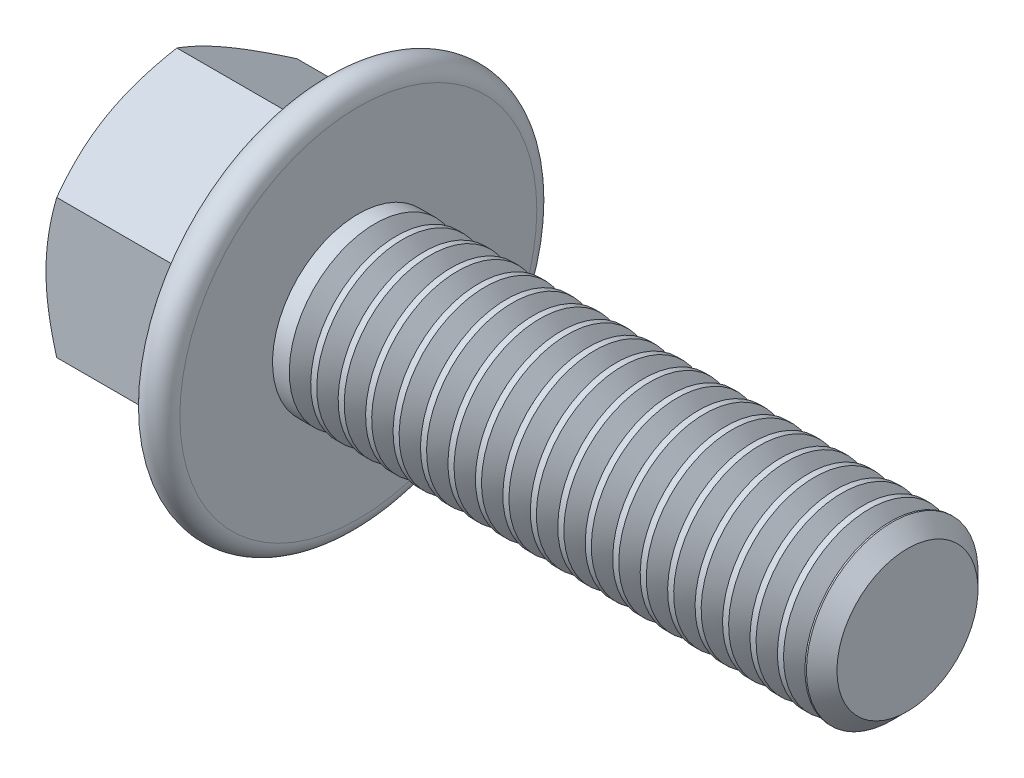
SolidWorks part; units mm, degrees
ref_plane "Plane1" through (0, 0, 0) normal (0, 0, 1) x (1, 0, 0)
ref_plane "Plane2" through (0, 0, 0) normal (0, 1, 0) x (1, 0, 0)
ref_plane "Plane3" through (0, 0, 0) normal (1, 0, 0) x (0, 0, -1)
sketch "Sketch1" plane through (0, 0, 0) normal (1, 0, 0) x (0, 0, -1)
  line L0 (3.5, 2.0207) -> (3.5, -2.0207)
  line L1 (-3.5, 2.0207) -> (-3.5, -2.0207)
  line L2 (3.5, -2.0207) -> (0, -4.0415)
  line L3 (0, -4.0415) -> (-3.5, -2.0207)
  line L4 (3.5, 2.0207) -> (0, 4.0415)
  line L5 (0, 4.0415) -> (-3.5, 2.0207)
  dimension "Width_flats" = 7
  dimension "D2" = 120
  dimension "D3" = 3.5
  dimension "D4" = 3.5
  dimension "D5" = 3.5
extrude "BaseHead" add sketch "Sketch1" along normal blind 5.6
sketch "BodySke" plane through (0, 0, 0) normal (0, 0, 1) x (1, 0, 0)
  line L0 (0, 2.0207) -> (0, -2.0207) construction
  line L1 (0, 0) -> (21.6, 0)
  line L2 (0, 0) -> (0, 2.5)
  line L3 (0, 2.5) -> (21.155, 2.5)
  line L4 (21.6, 0) -> (21.6, 2.055)
  line L5 (5.6, 4.0415) -> (5.6, 2.0207) construction
  line L6 (21.6, 2.055) -> (21.155, 2.5)
  line L7 (0, 0) -> (96.52, 0) construction
  line L8 (21.6, -2.055) -> (21.155, -2.5) construction
  line L9 (0, -2.5) -> (21.155, -2.5) construction
  line L10 (6.4, 15.24) -> (6.4, -1.27) construction
  line L11 (5.6, 15.24) -> (5.6, -1.27) construction
  line L12 (5.6, 2.0207) -> (5.6, -2.0207) construction
  dimension "Length" = 16
  dimension "Body_ch_ang" = 45
  dimension "Diameter" = 5
  dimension "Minor_dia" = 4.11
  dimension "Advance" = 0.8
  dimension "Thread_nom" = 16
revolve "BaseBody" add sketch "BodySke" angle 360 about L7
sketch "Sketch3" plane through (0, 0, 0) normal (0, 0, 1) x (1, 0, 0)
  line L0 (0, 3.5) -> (3.1994, 9.0415)
  line L1 (0, 4.0415) -> (0, 2.0207) construction
  line L2 (3.1994, 9.0415) -> (3.1994, 14.0415)
  line L3 (3.1994, 14.0415) -> (-10, 14.0415)
  line L4 (-10, 14.0415) -> (-10, 3.5)
  line L5 (-10, 3.5) -> (0, 3.5)
  line L6 (0, 0) -> (99.06, 0) construction
  line L7 (5.6, 4.0415) -> (0, 4.0415) construction
  dimension "D1" = 3.5
  dimension "D2" = 5
  dimension "D3" = 10
  dimension "D4" = 5
  dimension "Head_ch_ang" = 30
revolve "HeadChamfer" cut sketch "Sketch3" angle 360 about L6
sketch "Sketch4" plane through (0, 0, 0) normal (0, 0, 1) x (1, 0, 0)
  line L0 (2.6753, 0) -> (4.6302, 5.371)
  line L1 (5.6, 4.0415) -> (5.6, 2.0207) construction
  line L2 (4.6, 34.3444) -> (4.6, 16.9779) construction
  line L3 (5.6, 0) -> (5.6, 5.2)
  line L4 (8.3021, 5.7) -> (20.1618, 5.7) construction
  line L5 (0, 0) -> (95.25, 0) construction
  line L6 (0, 0) -> (96.52, 0) construction
  line L7 (2.6753, 0) -> (5.6, 0)
  line L8 (8.3021, -5.7) -> (20.1618, -5.7) construction
  arc A0 (5.6, 5.2) -> (4.6302, 5.371) centre (5.1, 5.2) ccw
  dimension "D1" = 20
  dimension "Flange_thickness" = 1
  dimension "Flange_dia" = 11.4
revolve "Flange" add sketch "Sketch4" angle 360 about L5
fillet "FlangeHexFillet" radius 0.1 6 edges
fillet "HeadFillet" [suppressed] radius 0.2
sketch "ThdSchSke" plane through (0, 0, 0) normal (0, 0, 1) x (1, 0, 0)
  line L0 (6.4, -2.055) -> (6.0884, -2.5)
  line L1 (6.4, -2.055) -> (6.7116, -2.5)
  line L2 (6.7116, -2.5) -> (6.7116, -3.125)
  line L3 (-3.175, 0) -> (5.1513, 0) construction
  line L5 (6.7116, -3.125) -> (6.0884, -3.125)
  line L6 (6.0884, -3.125) -> (6.0884, -2.5)
  dimension "Thread_minor" = 4.11
  dimension "Diameter" = 5
  dimension "Start" = 6.4
  dimension "SideAngle" = 55
  dimension "VeeAngle" = 70
  dimension "Overcut" = 6.25
revolve "ThreadSchematic" cut sketch "ThdSchSke" angle 360 about L3
pattern_linear "ThdSchPat" count 19 spacing 0.8 along (1, 0, 0) of "ThreadSchematic"
equation "\"D3@Sketch1\" = \"Width_flats@Sketch1\" / 2"
equation "\"D4@Sketch1\" = \"D3@Sketch1\""
equation "\"D5@Sketch1\" = \"D4@Sketch1\""
equation "\"Thread_minor@ThreadCosmetic\" = \"Minor_dia@BodySke\""
equation "\"D1@Sketch3\" = \"Width_flats@Sketch1\" / 2"
equation "\"Thread_length@ThreadCosmetic\" = ((sgn( (\"Length@BodySke\" - \"Advance@BodySke\" ) - \"Thread_nom@BodySke\" )-1)*( (\"Length@BodySke\" - \"Advance@BodySke\" ) - \"Thread_nom@BodySke\" ))/-2+ \"Thread_nom@BodySke\""
equation "\"Thread_minor@ThdSchSke\" = \"Minor_dia@BodySke\""
equation "\"Diameter@ThdSchSke\" = \"Diameter@BodySke\""
equation "\"Overcut@ThdSchSke\" = \"Diameter@BodySke\" * 1.25"
equation "\"Start@ThdSchSke\" = \"Head_ht@BaseHead\" + \"Length@BodySke\" - \"Thread_length@ThreadCosmetic\"  '---Non-countersunk---"
equation "\"Num_threads@ThdSchPat\" = int( \"Thread_length@ThreadCosmetic\" / \"Advance@BodySke\" + 0.999 )  + 1"
equation "\"Advance@ThdSchPat\" = \"Thread_length@ThreadCosmetic\" /  (\"Num_threads@ThdSchPat\" - 1) 'relax it"
equation "\"Num_threads@ThdSchPat\" = \"Num_threads@ThdSchPat\" - sgn( \"Num_threads@ThdSchPat\" - 1) '---chamfered tips only---"
